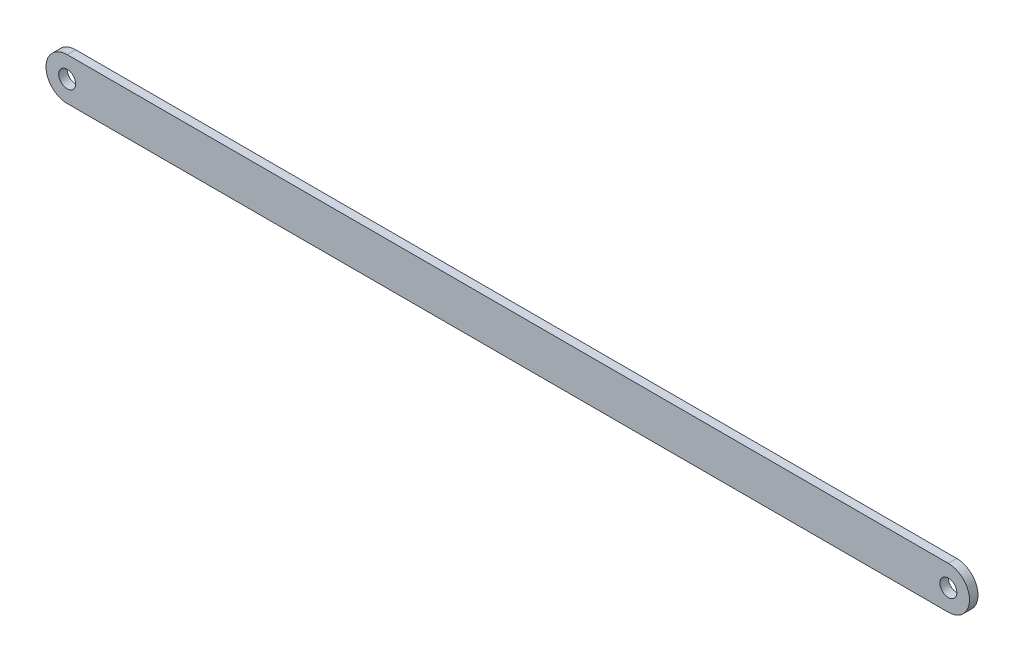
SolidWorks part; units mm, degrees
ref_plane "Front Plane" through (0, 0, 0) normal (0, 0, 1) x (1, 0, 0)
ref_plane "Top Plane" through (0, 0, 0) normal (0, 1, 0) x (1, 0, 0)
ref_plane "Right Plane" through (0, 0, 0) normal (1, 0, 0) x (0, 0, -1)
sketch "Sketch1" plane through (0, 0, 0) normal (0, 0, 1) x (1, 0, 0)
  line L0 (-260, 0) -> (260, 0) construction
  line L1 (-260, 12.5) -> (260, 12.5)
  line L2 (-260, -12.5) -> (260, -12.5)
  arc A0 (-260, 12.5) -> (-260, -12.5) centre (-260, 0) ccw
  arc A1 (260, -12.5) -> (260, 12.5) centre (260, 0) ccw
  point P2 (0, 0)
  dimension "D1" = 520
  dimension "D2" = 25
extrude "Boss-Extrude1" add sketch "Sketch1" along normal blind 5 contours A0 L2 A1 L1
hole_wizard "M8 Clearance Hole1" positions "Sketch2" profile "Sketch3" hole size "M8" standard "ANSI Metric"
sketch "Sketch2" plane through (0, 0, 5) normal (0, 0, 1) x (1, 0, 0)
  point P3 (260, 0)
  point P6 (-260, 0)
sketch "Sketch3" plane through (260, 0, 5) normal (1, 0, 0) x (0, -1, 0)
  line L0 (0, 0) -> (0, 5)
  line L1 (0, 5) -> (5, 5)
  line L2 (5, 5) -> (5, 0)
  line L5 (5, 0) -> (0, 0)
  line L11 (0, -6.35) -> (0, 107.95) construction
  dimension "Thru Hole Dia." = 10
  dimension "Thru Hole Depth" = 5
